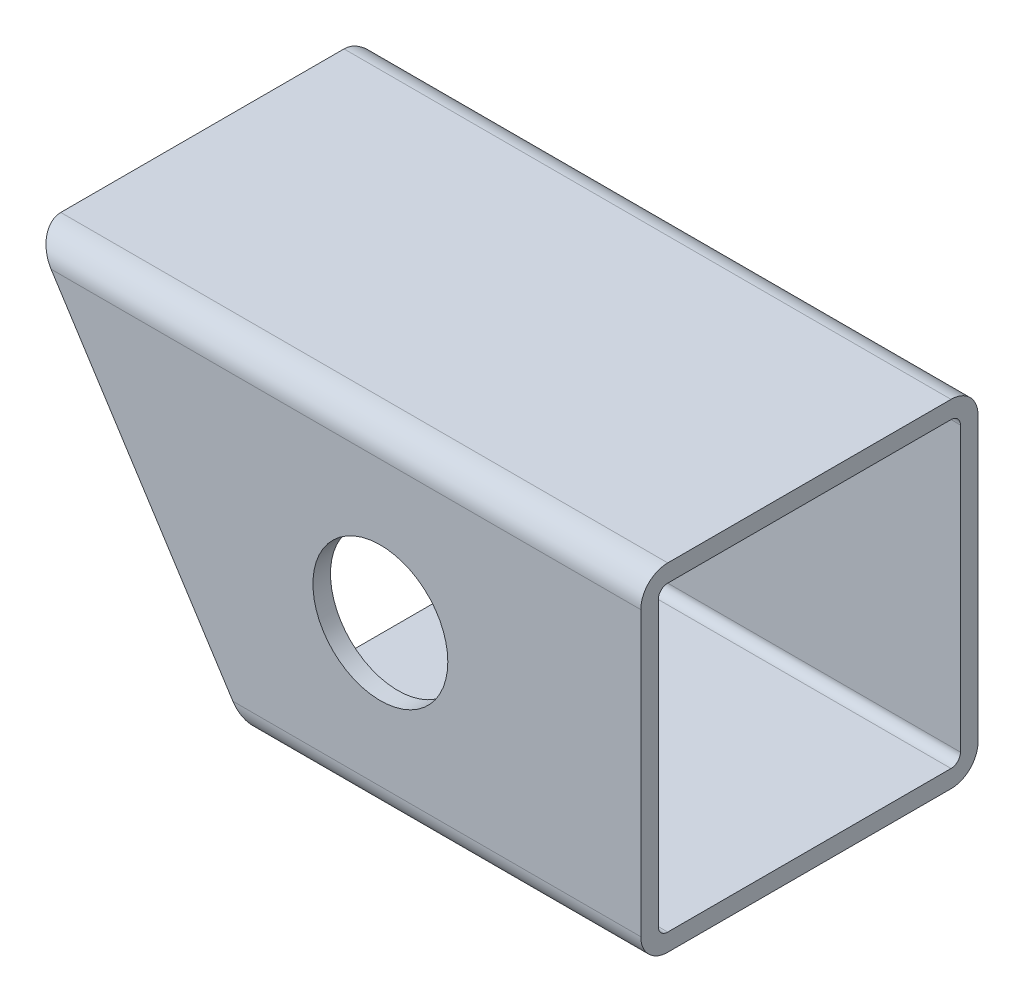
SolidWorks part; units mm, degrees
ref_plane "Front Plane" through (0, 0, 0) normal (0, 0, 1) x (1, 0, 0)
ref_plane "Top Plane" through (0, 0, 0) normal (0, 1, 0) x (1, 0, 0)
ref_plane "Right Plane" through (0, 0, 0) normal (1, 0, 0) x (0, 0, -1)
sketch "Sketch1" plane through (0, 0, 0) normal (1, 0, 0) x (0, 0, -1)
  line L0 (0, 2.54) -> (0, 29.21)
  line L1 (-2.54, 31.75) -> (-29.21, 31.75)
  line L2 (-31.75, 29.21) -> (-31.75, 2.54)
  line L3 (-29.21, 0) -> (-2.54, 0)
  line L4 (-1.651, 2.54) -> (-1.651, 29.21)
  line L5 (-2.54, 30.099) -> (-29.21, 30.099)
  line L6 (-30.099, 29.21) -> (-30.099, 2.54)
  line L7 (-29.21, 1.651) -> (-2.54, 1.651)
  arc A0 (-31.75, 2.54) -> (-29.21, 0) centre (-29.21, 2.54) ccw
  arc A1 (0, 2.54) -> (-2.54, 0) centre (-2.54, 2.54) cw
  arc A2 (0, 29.21) -> (-2.54, 31.75) centre (-2.54, 29.21) ccw
  arc A3 (-31.75, 29.21) -> (-29.21, 31.75) centre (-29.21, 29.21) cw
  arc A4 (-1.651, 29.21) -> (-2.54, 30.099) centre (-2.54, 29.21) ccw
  arc A5 (-30.099, 29.21) -> (-29.21, 30.099) centre (-29.21, 29.21) cw
  arc A6 (-30.099, 2.54) -> (-29.21, 1.651) centre (-29.21, 2.54) ccw
  arc A7 (-1.651, 2.54) -> (-2.54, 1.651) centre (-2.54, 2.54) cw
  point P12 (0, 0)
  point P15 (0, 31.75)
  point P18 (-31.75, 31.75)
  dimension "D3" = 2.54
  dimension "D1" = 31.75
  dimension "D2" = 31.75
  dimension "D4" = 1.651
extrude "Boss-Extrude1" add sketch "Sketch1" along normal blind 57.15
sketch "Sketch2" plane through (0, 0, 31.75) normal (0, 0, 1) x (1, 0, 0)
  line L0 (32.6336, 31.75) -> (32.6336, 0) construction
  line L1 (53.2274, 31.75) -> (12.0398, 31.75) construction
  line L2 (57.15, 0) -> (0, 0) construction
  circle A0 centre (32.6336, 15.875) radius 6.35
  dimension "D1" = 12.7
extrude "Cut-Extrude1" cut sketch "Sketch2" against normal blind 38.1
sketch "Sketch3" plane through (0, 0, 0) normal (0, 0, -1) x (-1, 0, 0)
  line L0 (0, 31.75) -> (-20.3769, 0)
  line L1 (-57.15, 0) -> (0, 0) construction
  line L2 (-20.3769, 0) -> (-17.3588, 0) construction
  line L3 (-20.3769, 0) -> (-26.0255, -8.8014)
  line L4 (-26.0255, -8.8014) -> (0, -8.8014)
  line L5 (0, -8.8014) -> (0, 31.75)
  line L6 (0, 2.54) -> (0, 29.21) construction
  dimension "D1" = 20.3769
  dimension "D2" = 26.0255
extrude "Cut-Extrude3" cut sketch "Sketch3" against normal blind 38.1
